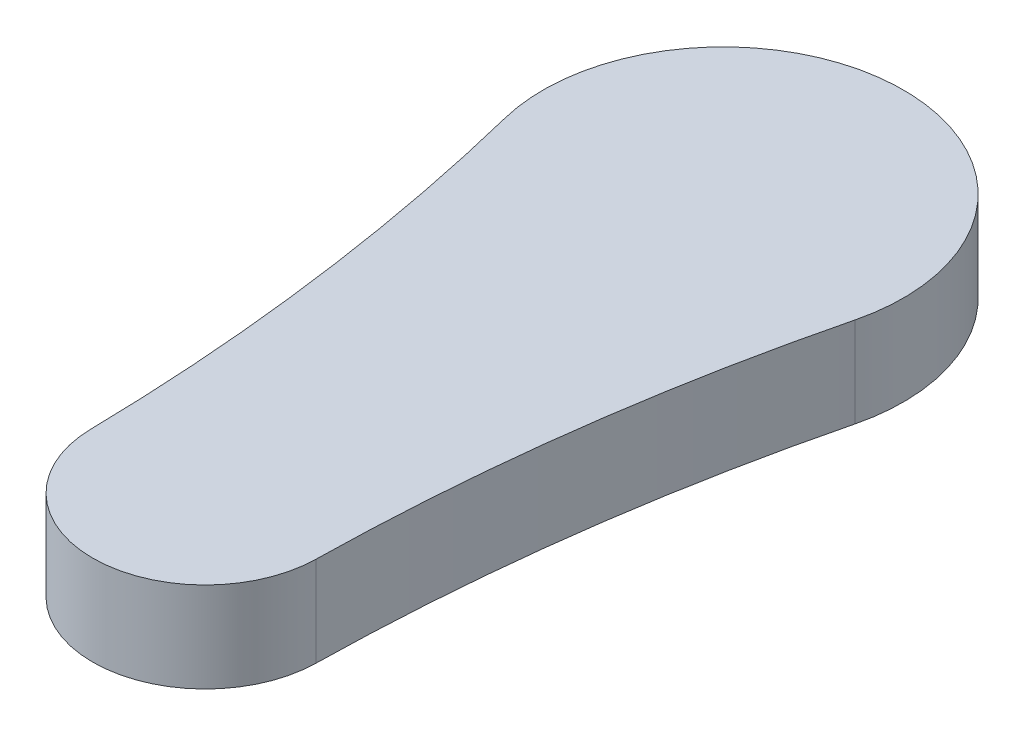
SolidWorks part; units mm, degrees
ref_plane "Front Plane" through (0, 0, 0) normal (0, 0, 1) x (1, 0, 0)
ref_plane "Top Plane" through (0, 0, 0) normal (0, 1, 0) x (1, 0, 0)
ref_plane "Right Plane" through (0, 0, 0) normal (1, 0, 0) x (0, 0, -1)
ref_plane "Plane1" through (0, 0, 0) normal (0, 1, 0) x (1, 0, 0)
sketch "Sketch1" plane through (0, 0, 0) normal (0, 1, 0) x (1, 0, 0)
  line L0 (0, -86.36) -> (0, 416.56) construction
  arc A0 (98.6131, 267.6457) -> (63.491, -1.0702) centre (1263.8109, -21.3031) ccw
  arc A1 (-63.491, -1.0702) -> (-98.6131, 267.6457) centre (-1263.8109, -21.3031) ccw
  arc A2 (98.6131, 267.6457) -> (-98.6131, 267.6457) centre (0, 292.1) ccw
  arc A3 (-63.491, -1.0702) -> (63.491, -1.0702) centre (0, 0) ccw
extrude "Extrude1" add sketch "Sketch1" along normal blind 50.8
